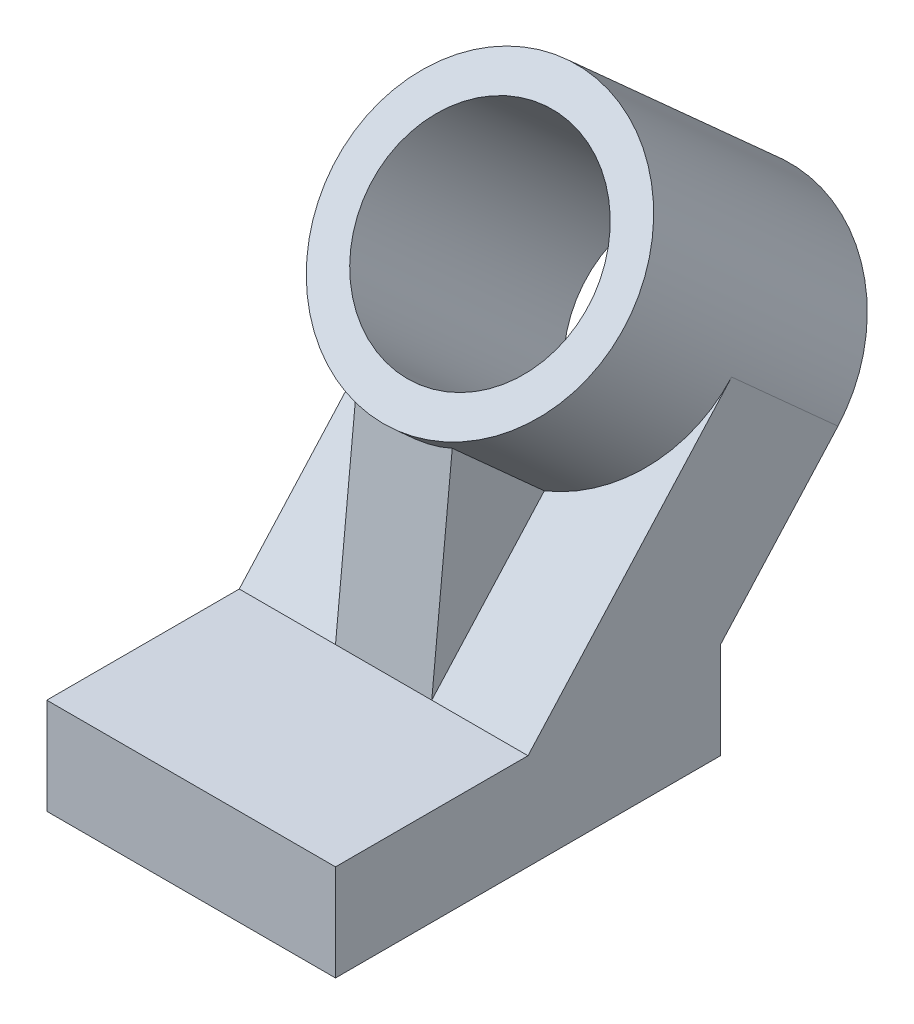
SolidWorks part; units mm, degrees
ref_plane "Front Plane" through (0, 0, 0) normal (0, 0, 1) x (1, 0, 0)
ref_plane "Top Plane" through (0, 0, 0) normal (0, 1, 0) x (1, 0, 0)
ref_plane "Right Plane" through (0, 0, 0) normal (1, 0, 0) x (0, 0, -1)
sketch "Sketch1" plane through (0, 0, 0) normal (1, 0, 0) x (0, 0, -1)
  line L0 (-50.8, 0) -> (50.8, 0)
  line L1 (-50.8, 0) -> (-50.8, 25.4)
  line L2 (50.8, 0) -> (50.8, 25.4)
  line L3 (-50.8, 25.4) -> (0, 25.4)
  line L4 (50.8, 25.4) -> (107.2856, 88.1336)
  line L5 (0, 25.4) -> (79.2305, 113.3944)
  line L6 (107.2856, 88.1336) -> (79.2305, 113.3944)
  dimension "D1" = 101.6
  dimension "D2" = 25.4
  dimension "D3" = 48
  dimension "D4" = 50.8
  dimension "D5" = 152.4
extrude "Boss-Extrude1" add sketch "Sketch1" along normal mid plane 76.2
ref_plane "Plane4" through (0, 11.3725, 12.6304) normal (0, 0.6691, 0.7431) x (1, 0, 0)
sketch "Sketch6" plane through (0, 11.3725, 12.6304) normal (0, 0.6691, 0.7431) x (1, 0, 0)
  line L1 (0, -33.9918) -> (0, 137.284) construction
  line L2 (38.1, -33.9918) -> (-38.1, -33.9918) construction
  line L4 (38.1, -15.116) -> (-38.1, -15.116) construction
  line L5 (38.1, 99.184) -> (38.1, 137.284)
  line L6 (-38.1, 99.184) -> (-38.1, 137.284)
  line L7 (38.1, 137.284) -> (-38.1, 137.284)
  arc A0 (38.1, 99.184) -> (-38.1, 99.184) centre (0, 99.184) ccw
  dimension "D2" = 76.2
  dimension "D1" = 114.3
  dimension "D3" = 76.2
  dimension "D4" = 152.4
extrude "Cut-Extrude5" cut sketch "Sketch6" against normal blind 38.1 contours A0 L7 L6 | A0 L5 L7
ref_plane "Plane5" through (0, 11.3725, 12.6304) normal (0, 0.6691, 0.7431) x (1, 0, 0)
sketch "Sketch7" plane through (0, 11.3725, 12.6304) normal (0, 0.6691, 0.7431) x (1, 0, 0)
  line L0 (0, -33.9918) -> (0, 137.284) construction
  line L1 (38.1, -33.9918) -> (-38.1, -33.9918) construction
  line L2 (38.1, -15.116) -> (-38.1, -15.116) construction
  arc A0 (38.1, 99.184) -> (-38.1, 99.184) centre (0, 99.184) ccw construction
  circle A1 centre (0, 99.184) radius 38.1
  dimension "D1" = 114.3
  dimension "D2" = 76.2
extrude "Boss-Extrude2" add sketch "Sketch7" along normal blind 38.1
ref_plane "Plane6" through (0, 36.8664, 40.9442) normal (0, 0.6691, 0.7431) x (1, 0, 0)
sketch "Sketch8" plane through (0, 36.8664, 40.9442) normal (0, 0.6691, 0.7431) x (1, 0, 0)
  line L0 (-38.1, 99.184) -> (38.1, 99.184) construction
  line L1 (0, 137.284) -> (0, 61.084) construction
  circle A0 centre (0, 99.184) radius 38.1 construction
  arc A1 (-38.1, 99.184) -> (38.1, 99.184) centre (0, 99.184) ccw construction
  circle A2 centre (0, 99.184) radius 28.575
  dimension "D1" = 57.15
extrude "Cut-Extrude6" cut sketch "Sketch8" against normal up to next
sketch "Sketch11" plane through (0, 0, 0) normal (1, 0, 0) x (0, 0, -1)
  line L0 (6.3024, 89.3391) -> (0, 25.4)
rib "Rib12" sketch "Sketch11" sketch "Sketch11" thickness 25.4 extrusion direction parallel to sketch draft on no parameters "D1"=25.4
